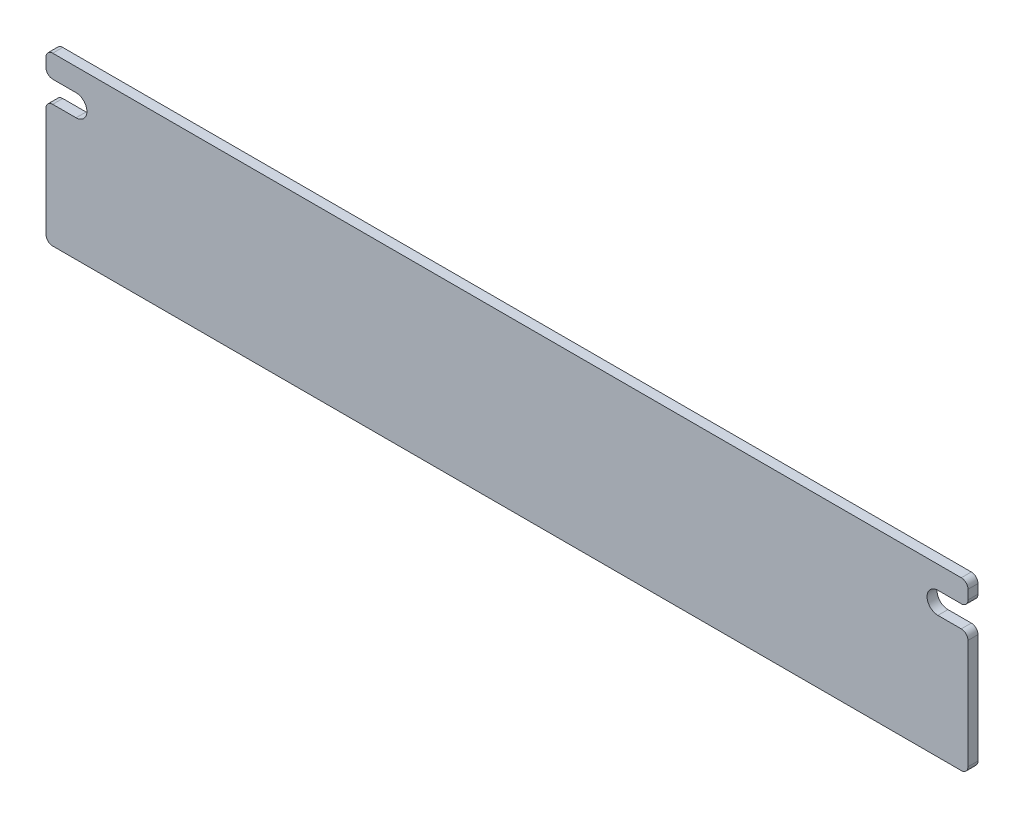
SolidWorks part; units mm, degrees
ref_plane "Plan1" through (0, 0, 0) normal (0, 0, 1) x (1, 0, 0)
ref_plane "Plan2" through (0, 0, 0) normal (0, 1, 0) x (1, 0, 0)
ref_plane "Plan3" through (0, 0, 0) normal (1, 0, 0) x (0, 0, -1)
sketch "Esquisse1" plane through (0, 0, 0) normal (0, 0, 1) x (1, 0, 0)
  line L0 (0, 30) -> (0, -30) construction
  line L1 (-138, 25) -> (138, 25)
  line L2 (-138, 25) -> (-138, 18.25)
  line L3 (-138, -25) -> (138, -25)
  line L4 (138, 25) -> (138, 18.25)
  line L5 (-29.732, 0) -> (29.732, 0) construction
  line L6 (129, 18.25) -> (138, 18.25)
  line L7 (124.0731, 15) -> (139.6558, 15) construction
  line L8 (129, 11.75) -> (138, 11.75)
  line L9 (138, 11.75) -> (138, -25)
  line L10 (-129, 11.75) -> (-138, 11.75)
  line L11 (-129, 18.25) -> (-138, 18.25)
  line L12 (-138, 11.75) -> (-138, -25)
  arc A0 (129, 18.25) -> (129, 11.75) centre (129, 15) ccw
  arc A1 (-129, 11.75) -> (-129, 18.25) centre (-129, 15) ccw
  dimension "D6" = 6.5
  dimension "D3" = 258
  dimension "D4" = 10
  dimension "D1" = 50
  dimension "D2" = 276
extrude "Base-Extrusion" add sketch "Esquisse1" along normal blind 3
fillet "Congé1" radius 2
